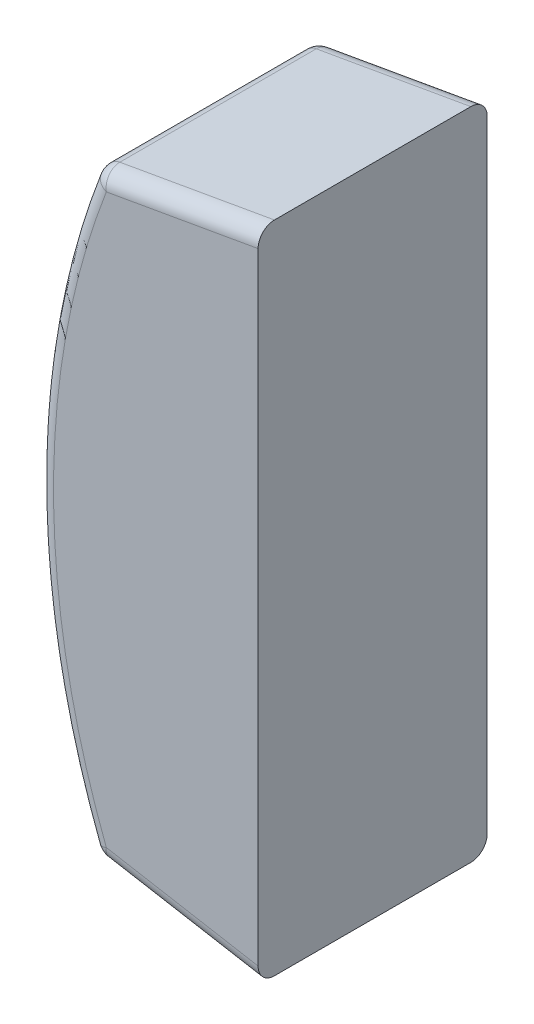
SolidWorks part; units mm, degrees
ref_plane "Plan de face" through (0, 0, 0) normal (0, 0, 1) x (1, 0, 0)
ref_plane "Plan de dessus" through (0, 0, 0) normal (0, 1, 0) x (1, 0, 0)
ref_plane "Plan de droite" through (0, 0, 0) normal (1, 0, 0) x (0, 0, -1)
sketch "Esquisse1" plane through (0, 0, 0) normal (0, 0, 1) x (1, 0, 0)
  line L0 (0, 0) -> (0, 80)
  line L1 (0, 80) -> (-20, 76.4735)
  line L2 (0, 0) -> (-20, 3.5265)
  line L3 (-20, 76.4735) -> (-20, 3.5265) construction
  line L4 (0, 40) -> (-27, 40) construction
  line L5 (-27, 64.2725) -> (-27, 16.2847) construction
  arc A0 (-20, 76.4735) -> (-20, 3.5265) centre (71.5224, 40) ccw
  dimension "D4" = 80
  dimension "D1" = 80
  dimension "D2" = 20
  dimension "D3" = 7
extrude "Boss.-Extru.1" add sketch "Esquisse1" along normal blind 28
fillet "Congé1" radius 2 8 edges at (-10, 1.7633, 0) (-10, 1.7633, 28) (-20, 3.5265, 14) (-27, 40, 0) (-27, 40, 28) (-10, 78.2367, 0) (-10, 78.2367, 28) (-20, 76.4735, 14)
